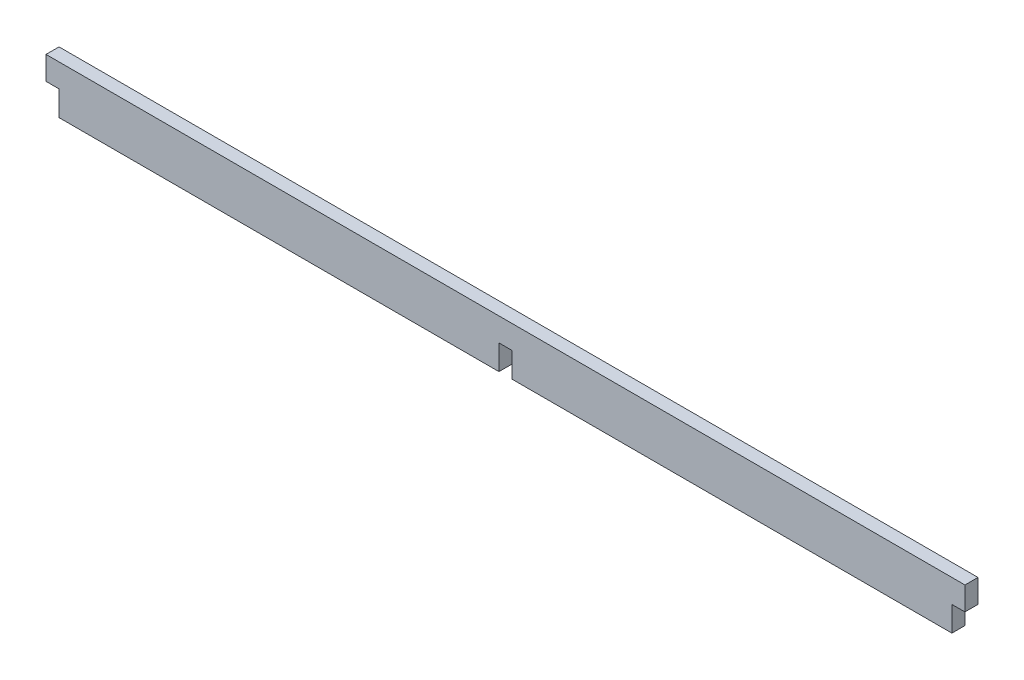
SolidWorks part; units mm, degrees
ref_plane "Front Plane" through (0, 0, 0) normal (0, 0, 1) x (1, 0, 0)
ref_plane "Top Plane" through (0, 0, 0) normal (0, 1, 0) x (1, 0, 0)
ref_plane "Right Plane" through (0, 0, 0) normal (1, 0, 0) x (0, 0, -1)
sketch "Sketch1" plane through (0, 0, 0) normal (0, 0, 1) x (1, 0, 0)
  line L0 (114.315, 8.3843) -> (222.225, 8.3843)
  line L1 (3.2, 8.3843) -> (111.115, 8.3843)
  line L2 (0, 14.49) -> (0, 20.2223)
  line L3 (0, 20.2223) -> (225.425, 20.2223)
  line L4 (225.425, 14.49) -> (225.425, 20.2223)
  line L7 (0, 14.49) -> (3.2, 14.49)
  line L8 (3.2, 8.3843) -> (3.2, 14.49)
  line L10 (111.115, 8.3843) -> (111.115, 14.49)
  line L11 (111.115, 14.49) -> (114.315, 14.49)
  line L12 (114.315, 8.3843) -> (114.315, 14.49)
  line L15 (225.425, 14.49) -> (222.225, 14.49)
  line L16 (222.225, 8.3843) -> (222.225, 14.49)
  dimension "D2" = 3.2
  dimension "D3" = 3.2
  dimension "D4" = 3.2
  dimension "D5" = 5.7323
  dimension "D6" = 11.838
  dimension "D7" = 5.7323
  dimension "D8" = 5.7323
  dimension "D9" = 107.915
extrude "Boss-Extrude1" add sketch "Sketch1" along normal blind 3.2 contours L3 L4 L15 L16 L0 L12 L11 L10 L1 L8 L7 L2
